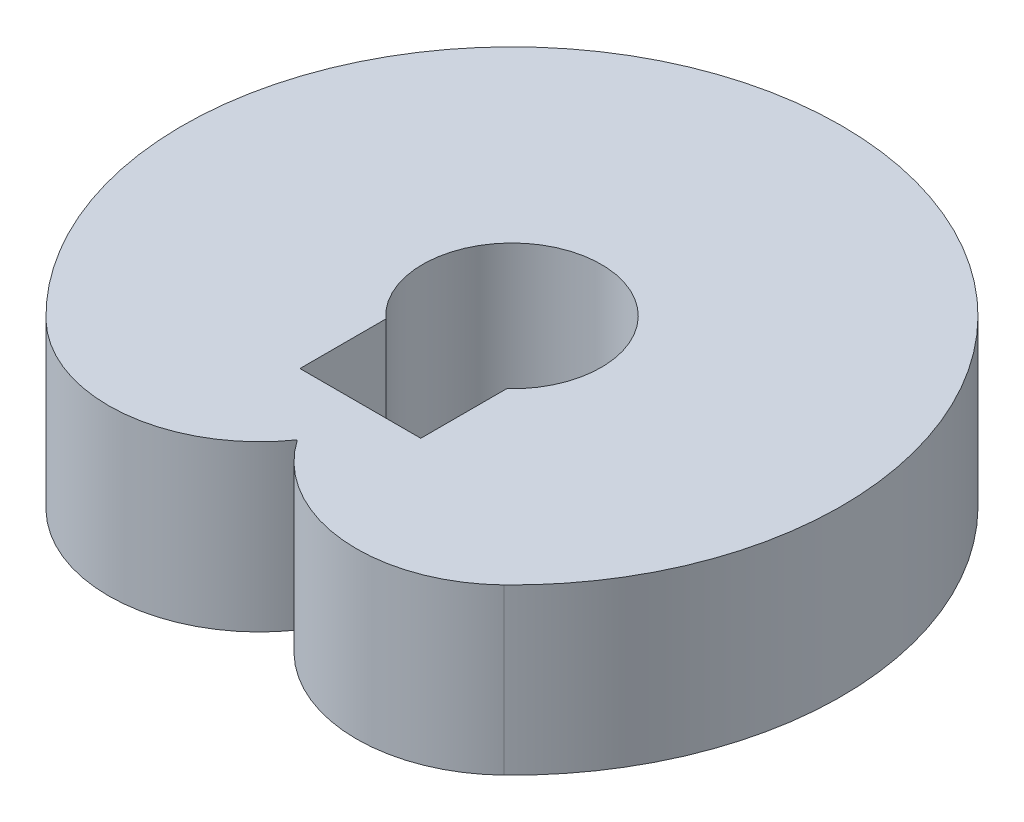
SolidWorks part; units mm, degrees
ref_plane "前视基准面" through (0, 0, 0) normal (0, 0, 1) x (1, 0, 0)
ref_plane "上视基准面" through (0, 0, 0) normal (0, 1, 0) x (1, 0, 0)
ref_plane "右视基准面" through (0, 0, 0) normal (1, 0, 0) x (0, 0, -1)
sketch "草图1" plane through (0, 0, 0) normal (0, 1, 0) x (1, 0, 0)
  line L0 (0, 0) -> (0, 325) construction
  line L1 (0, 325) -> (0, 600) construction
  line L2 (0, 0) -> (416.795, -431.6039) construction
  line L3 (0, 0) -> (-416.795, -431.6039) construction
  line L4 (0, 325) -> (137.5, 86.843) construction
  line L5 (0, 325) -> (-137.5, 86.843) construction
  line L6 (-225.764, -233.7854) -> (38.583, -157.9852) construction
  line L7 (225.764, -233.7854) -> (-38.583, -157.9852) construction
  line L8 (225.764, -233.7854) -> (159.2354, 33.0459) construction
  line L9 (-225.764, -233.7854) -> (-159.2354, 33.0459) construction
  circle A0 centre (0, 0) radius 325 construction
  arc A1 (137.5, 86.843) -> (-137.5, 86.843) centre (0, 325) ccw construction
  arc A2 (416.795, -431.6039) -> (-416.795, -431.6039) centre (0, 0) ccw
  arc A3 (-38.583, -157.9852) -> (159.2354, 33.0459) centre (225.764, -233.7854) ccw construction
  arc A4 (0, -390.8065) -> (416.795, -431.6039) centre (225.764, -233.7854) ccw
  circle A5 centre (0, 0) radius 162.6283
  arc A6 (-159.2354, 33.0459) -> (38.583, -157.9852) centre (-225.764, -233.7854) ccw construction
  arc A7 (-416.795, -431.6039) -> (0, -390.8065) centre (-225.764, -233.7854) ccw
  dimension "D1" = 325
  dimension "D2" = 275
  dimension "D3" = 136
  dimension "D4" = 136
  dimension "D5" = 150
  dimension "D6" = 150
  dimension "D7" = 150
  dimension "D8" = 150
  dimension "D9" = 150
  dimension "D10" = 150
extrude "凸台-拉伸1" add sketch "草图1" against normal blind 300
sketch "草图2" plane through (0, 0, 0) normal (0, 1, 0) x (1, 0, 0)
  line L0 (0, 386.9644) -> (0, -729.3396) construction
  line L1 (-110, -119.783) -> (110, -119.783)
  line L2 (-110, -119.783) -> (-110, -276)
  line L3 (-110, -276) -> (110, -276)
  line L4 (110, -119.783) -> (110, -276)
  circle A0 centre (0, 0) radius 162.6283 construction
  dimension "D1" = 276
  dimension "D2" = 220
extrude "切除-拉伸1" cut sketch "草图2" against normal through all
